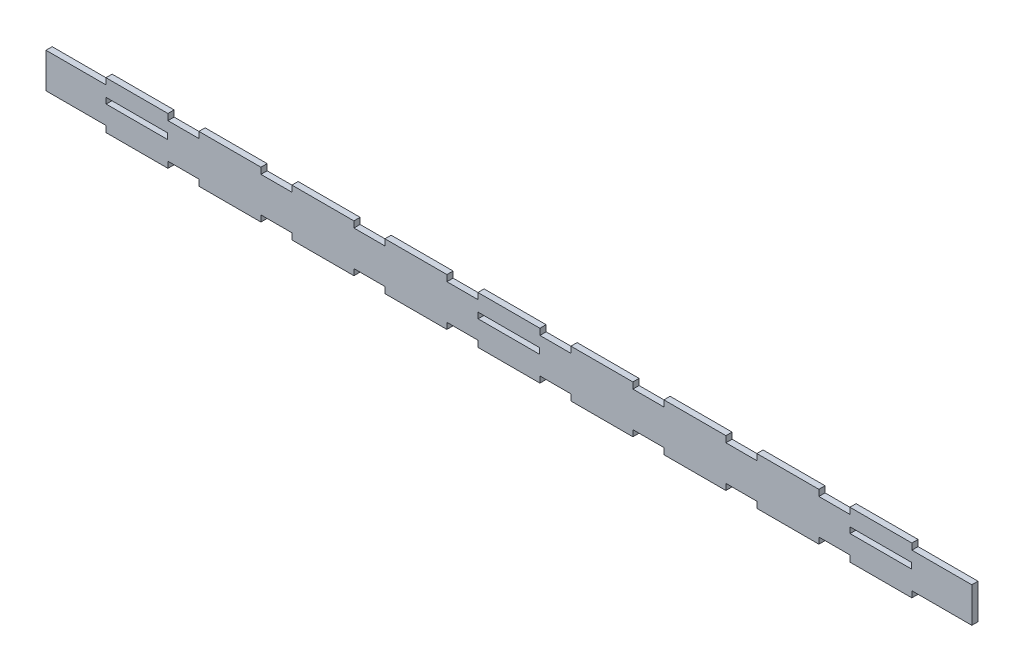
SolidWorks part; units mm, degrees
ref_plane "Alzado" through (0, 0, 0) normal (0, 0, 1) x (1, 0, 0)
ref_plane "Planta" through (0, 0, 0) normal (0, 1, 0) x (1, 0, 0)
ref_plane "Vista lateral" through (0, 0, 0) normal (1, 0, 0) x (0, 0, -1)
sketch "Croquis1" plane through (0, 0, 0) normal (0, 0, 1) x (1, 0, 0)
  line L1 (-224, -8.5) -> (224, -8.5)
  line L2 (-224, -8.5) -> (-224, 8.5)
  line L3 (-224, 8.5) -> (224, 8.5)
  line L4 (224, -8.5) -> (224, 8.5)
  line L5 (-224, -8.5) -> (224, 8.5) construction
  line L6 (-224, 8.5) -> (224, -8.5) construction
  point P0 (0, 0)
  dimension "D1" = 17
  dimension "D2" = 448
extrude "Saliente-Extruir1" add sketch "Croquis1" along normal blind 3
sketch "Croquis2" plane through (0, 8.5, 0) normal (0, 1, 0) x (1, 0, 0)
  line L0 (224, 0) -> (-224, 0) construction
  line L1 (-15, 0) -> (15, 0)
  line L2 (-15, 0) -> (-15, -3)
  line L3 (-15, -3) -> (15, -3)
  line L4 (15, 0) -> (15, -3)
  line L5 (224, -3) -> (-224, -3) construction
  line L6 (0, 0) -> (0, -3) construction
  line L7 (-30, 0) -> (-60, 0)
  line L8 (-30, 0) -> (-30, -3)
  line L9 (-30, -3) -> (-60, -3)
  line L10 (-60, 0) -> (-60, -3)
  line L11 (-75, 0) -> (-105, 0)
  line L12 (-75, 0) -> (-75, -3)
  line L13 (-75, -3) -> (-105, -3)
  line L14 (-105, 0) -> (-105, -3)
  line L15 (-120, 0) -> (-150, 0)
  line L16 (-120, 0) -> (-120, -3)
  line L17 (-120, -3) -> (-150, -3)
  line L18 (-150, 0) -> (-150, -3)
  line L19 (150, 0) -> (150, -3)
  line L20 (120, -3) -> (150, -3)
  line L21 (120, 0) -> (120, -3)
  line L22 (120, 0) -> (150, 0)
  line L23 (105, 0) -> (105, -3)
  line L24 (75, -3) -> (105, -3)
  line L25 (75, 0) -> (75, -3)
  line L26 (75, 0) -> (105, 0)
  line L27 (60, 0) -> (60, -3)
  line L28 (30, -3) -> (60, -3)
  line L29 (30, 0) -> (30, -3)
  line L30 (30, 0) -> (60, 0)
  line L31 (195, -3) -> (195, 0)
  line L32 (-165, -3) -> (-195, -3)
  line L33 (-165, -3) -> (-165, 0)
  line L34 (-165, 0) -> (-195, 0)
  line L35 (-195, -3) -> (-195, 0)
  line L36 (165, 0) -> (195, 0)
  line L37 (165, -3) -> (165, 0)
  line L38 (165, -3) -> (195, -3)
  point P8 (0, 0)
  point P24 (-45, 0)
  point P25 (-90, 0)
  point P26 (-135, 0)
  point P43 (-180, 0)
  dimension "D1" = 30
  dimension "D2" = 45
  dimension "D3" = 30
  dimension "D4" = 45
  dimension "D5" = 30
  dimension "D6" = 45
  dimension "D7" = 30
  dimension "D8" = 30
  dimension "D9" = 45
extrude "Saliente-Extruir2" add sketch "Croquis2" along normal blind 3
sketch "Croquis4" plane through (0, -8.5, 0) normal (0, -1, 0) x (1, 0, 0)
  line L0 (-224, 0) -> (224, 0) construction
  line L1 (15, 0) -> (-15, 0)
  line L2 (15, 0) -> (15, 3)
  line L3 (15, 3) -> (-15, 3)
  line L4 (-15, 0) -> (-15, 3)
  line L5 (-224, 3) -> (224, 3) construction
  line L6 (0, 0) -> (0, 3) construction
  line L7 (30, 0) -> (60, 0)
  line L8 (30, 0) -> (30, 3)
  line L9 (30, 3) -> (60, 3)
  line L10 (60, 0) -> (60, 3)
  line L11 (75, 0) -> (105, 0)
  line L12 (75, 0) -> (75, 3)
  line L13 (75, 3) -> (105, 3)
  line L14 (105, 0) -> (105, 3)
  line L15 (120, 0) -> (150, 0)
  line L16 (120, 0) -> (120, 3)
  line L17 (120, 3) -> (150, 3)
  line L18 (150, 0) -> (150, 3)
  line L19 (-150, 0) -> (-150, 3)
  line L20 (-120, 3) -> (-150, 3)
  line L21 (-120, 0) -> (-120, 3)
  line L22 (-120, 0) -> (-150, 0)
  line L23 (-105, 0) -> (-105, 3)
  line L24 (-75, 3) -> (-105, 3)
  line L25 (-75, 0) -> (-75, 3)
  line L26 (-75, 0) -> (-105, 0)
  line L27 (-60, 0) -> (-60, 3)
  line L28 (-30, 3) -> (-60, 3)
  line L29 (-30, 0) -> (-30, 3)
  line L30 (-30, 0) -> (-60, 0)
  line L31 (-165, 0) -> (-165, 3)
  line L32 (195, 0) -> (165, 0)
  line L33 (195, 0) -> (195, 3)
  line L34 (195, 3) -> (165, 3)
  line L35 (165, 0) -> (165, 3)
  line L36 (-195, 3) -> (-165, 3)
  line L37 (-195, 0) -> (-195, 3)
  line L38 (-195, 0) -> (-165, 0)
  point P8 (0, 0)
  point P26 (45, 0)
  point P27 (90, 0)
  point P28 (135, 0)
  point P43 (180, 3)
  point P44 (135, 3)
  dimension "D1" = 30
  dimension "D2" = 45
  dimension "D3" = 30
  dimension "D4" = 45
  dimension "D5" = 30
  dimension "D6" = 45
  dimension "D7" = 30
  dimension "D8" = 30
  dimension "D9" = 45
extrude "Saliente-Extruir3" add sketch "Croquis4" along normal blind 3
sketch "Croquis5" plane through (0, 0, 0) normal (0, 0, -1) x (-1, 0, 0)
  line L1 (-194.9, 3.3) -> (-165.1, 3.3)
  line L2 (-194.9, 3.3) -> (-194.9, 0.5)
  line L3 (-194.9, 0.5) -> (-165.1, 0.5)
  line L4 (-165.1, 3.3) -> (-165.1, 0.5)
  line L5 (-194.9, 3.3) -> (-165.1, 0.5) construction
  line L6 (-194.9, 0.5) -> (-165.1, 3.3) construction
  line L7 (-14.9, 0.5) -> (14.9, 0.5)
  line L8 (-14.9, 0.5) -> (-14.9, 3.3)
  line L9 (-14.9, 3.3) -> (14.9, 3.3)
  line L10 (14.9, 0.5) -> (14.9, 3.3)
  line L11 (-14.9, 0.5) -> (14.9, 3.3) construction
  line L12 (-14.9, 3.3) -> (14.9, 0.5) construction
  line L13 (165.1, 0.5) -> (194.9, 0.5)
  line L14 (165.1, 0.5) -> (165.1, 3.3)
  line L15 (165.1, 3.3) -> (194.9, 3.3)
  line L16 (194.9, 0.5) -> (194.9, 3.3)
  line L17 (165.1, 0.5) -> (194.9, 3.3) construction
  line L18 (165.1, 3.3) -> (194.9, 0.5) construction
  line L19 (-150, -8.5) -> (-165, -8.5) construction
  line L20 (-15, -8.5) -> (-30, -8.5) construction
  line L22 (120, -8.5) -> (105, -8.5) construction
  line L23 (-195, -11.5) -> (-165, -11.5) construction
  line L24 (165, -11.5) -> (195, -11.5) construction
  point P0 (-180, 1.9)
  point P5 (0, 1.9)
  point P11 (180, 1.9)
  point P37 (-180, -11.5)
  point P43 (180, -11.5)
  dimension "D1" = 2.8
  dimension "D2" = 9
  dimension "D3" = 2.8
  dimension "D4" = 29.8
  dimension "D5" = 29.8
  dimension "D6" = 9
  dimension "D7" = 29.8
  dimension "D8" = 2.8
  dimension "D9" = 9
extrude "Cortar-Extruir1" cut sketch "Croquis5" against normal up to next
